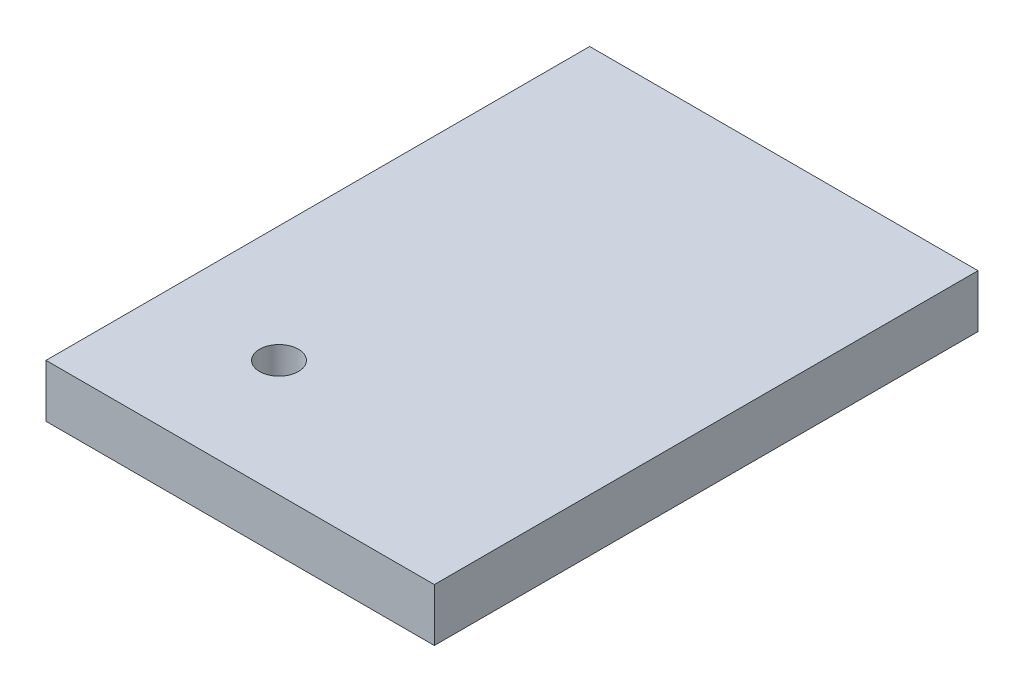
SolidWorks part; units mm, degrees
ref_plane "Front" through (0, 0, 0) normal (0, 0, 1) x (1, 0, 0)
ref_plane "Top" through (0, 0, 0) normal (0, 1, 0) x (1, 0, 0)
ref_plane "Right" through (0, 0, 0) normal (1, 0, 0) x (0, 0, -1)
sketch "Sketch1" plane through (0, 0, 0) normal (0, 1, 0) x (1, 0, 0)
  line L0 (-63.5, -88.9) -> (63.5, 88.9) construction
  line L1 (-63.5, 88.9) -> (63.5, 88.9)
  line L2 (-63.5, 88.9) -> (-63.5, -88.9)
  line L3 (-63.5, -88.9) -> (63.5, -88.9)
  line L4 (63.5, 88.9) -> (63.5, -88.9)
  dimension "D1" = 177.8
  dimension "D2" = 127
extrude "Extrude1" add sketch "Sketch1" along normal blind 17.272
sketch "Sketch2" plane through (0, 17.272, 0) normal (0, 1, 0) x (1, 0, 0)
  line L0 (-63.5, -88.9) -> (63.5, -88.9) construction
  line L2 (-63.5, 88.9) -> (-63.5, -88.9) construction
  circle A0 centre (-25.4, -50.8) radius 6.35
  dimension "D1" = 12.7
  dimension "D4" = 38.1
  dimension "D2" = 38.1
extrude "Cut-Extrude1" cut sketch "Sketch2" against normal through all
